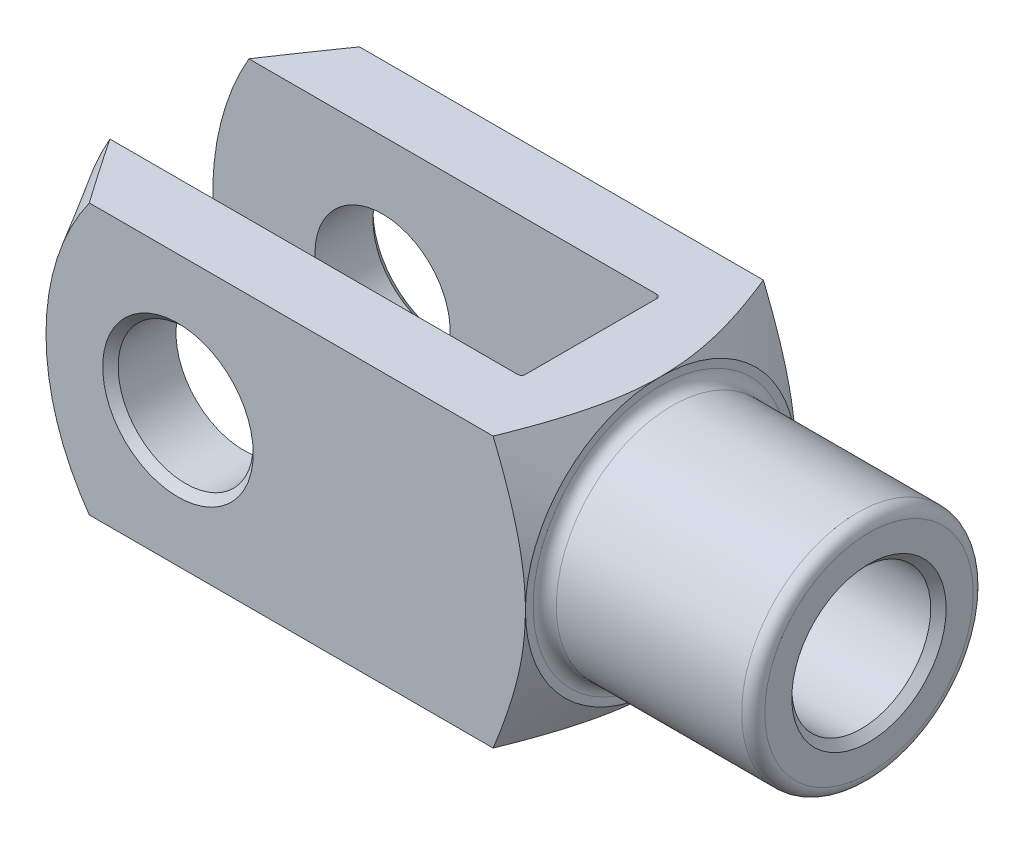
SolidWorks part; units mm, degrees
ref_plane "Front Plane" through (0, 0, 0) normal (0, 0, 1) x (1, 0, 0)
ref_plane "Top Plane" through (0, 0, 0) normal (0, 1, 0) x (1, 0, 0)
ref_plane "Right Plane" through (0, 0, 0) normal (1, 0, 0) x (0, 0, -1)
sketch "Sketch1" plane through (0, 0, 0) normal (1, 0, 0) x (0, 0, -1)
  line L0 (0, 0) -> (0, 50000) construction
  line L1 (0, 0) -> (50000, 0) construction
  line L2 (-35, -35) -> (-35, 35)
  line L3 (-35, 35) -> (35, 35)
  line L4 (35, -35) -> (35, 35)
  line L5 (-35, -35) -> (35, -35)
  point P9 (0, 35)
  point P11 (35, 0)
  point P12 (-35, 0)
  dimension "D1" = 70
  dimension "D2" = 70
extrude "Extrude1" add sketch "Sketch1" against normal blind 188
sketch "Sketch2" plane through (0, 0, 0) normal (1, 0, 0) x (0, 0, -1)
  circle A0 centre (0, 0) radius 30
  circle A1 centre (0, 0) radius 60
  dimension "D1" = 60
  dimension "D2" = 120
extrude "Extrude2" cut sketch "Sketch2" against normal blind 54
sketch "Sketch3" plane through (0, 0, 35) normal (0, 0, 1) x (1, 0, 0)
  circle A0 centre (-144, 0) radius 17.5
  dimension "D1" = 35
  dimension "D2" = 144
extrude "Extrude3" cut sketch "Sketch3" against normal through all
sketch "Sketch4" plane through (0, 35, 0) normal (0, 1, 0) x (1, 0, 0)
  line L0 (0, 0) -> (-50000, 0) construction
  line L1 (-188, -18) -> (-188, 18)
  line L2 (-188, 35) -> (-188, -35) construction
  line L3 (-188, 18) -> (-72, 18)
  line L4 (-72, 18) -> (-72, -18)
  line L5 (-144, 35) -> (-144, -35) construction
  line L6 (-188, -18) -> (-72, -18)
  point P7 (-144, 0)
  point P13 (-72, 0)
  point P14 (-188, 0)
  dimension "D1" = 72
  dimension "D2" = 36
extrude "Extrude4" cut sketch "Sketch4" against normal through all
fillet "Fillet1" radius 1 2 edges at (-72, 0, 18) (-72, 0, -18)
fillet "Fillet2" radius 3 2 edges at (0, 0, -30) (-54, 0, -30)
chamfer "Chamfer2" distance 2 angle 45 2 edges at (-126.5, 0, -35) (-126.5, 0, 35)
sketch "Sketch6" plane through (0, 0, 0) normal (0, 0, 1) x (1, 0, 0)
  line L0 (-54, -35) -> (-54, -70)
  line L1 (-54, -70) -> (-74.2073, -70)
  line L2 (-74.2073, -70) -> (-54, -35)
  dimension "D1" = 30
  dimension "D2" = 70
revolve "Cut-Revolve1" cut sketch "Sketch6" angle 360 about axis through (-54, 0, 0) along (1, 0, 0)
sketch "Sketch7" plane through (0, 0, 0) normal (0, 1, 0) x (1, 0, 0)
  line L0 (-178.185, -35) -> (-188, -18)
  line L1 (-188, 18) -> (-178.185, 35)
  line L2 (-178.185, 35) -> (-258, 35)
  line L3 (-188, 18) -> (-188, -18)
  line L4 (-258, 35) -> (-258, -35)
  line L5 (-258, -35) -> (-178.185, -35)
  line L6 (-188, 35) -> (-62.3701, 35) construction
  line L7 (-188, -35) -> (-62.3701, -35) construction
  line L8 (-118, 0.6162) -> (-118, 50000.6162) construction
  dimension "D1" = 120
  dimension "D2" = 70
  dimension "D3" = 70
revolve "Cut-Revolve2" cut sketch "Sketch7" angle 180 about L8
sketch "Sketch8" plane through (0, 0, 0) normal (1, 0, 0) x (0, 0, -1)
  circle A0 centre (0, 0) radius 18
  dimension "D1" = 36
extrude "Extrude5" cut sketch "Sketch8" against normal through all
chamfer "Chamfer3" distance 2 angle 45 1 edges at (0, 0, -18)
equation "\"D2@Sketch1\" = \"D1@Sketch1\""
equation "\"D2@Sketch2\" = \"D1@Sketch2\"*2"
equation "\"D2@Sketch6\" = \"D1@Sketch1\""
equation "\"D2@Sketch7\" = \"D1@Sketch1\""
equation "\"D3@Sketch7\" = \"D1@Sketch1\""
